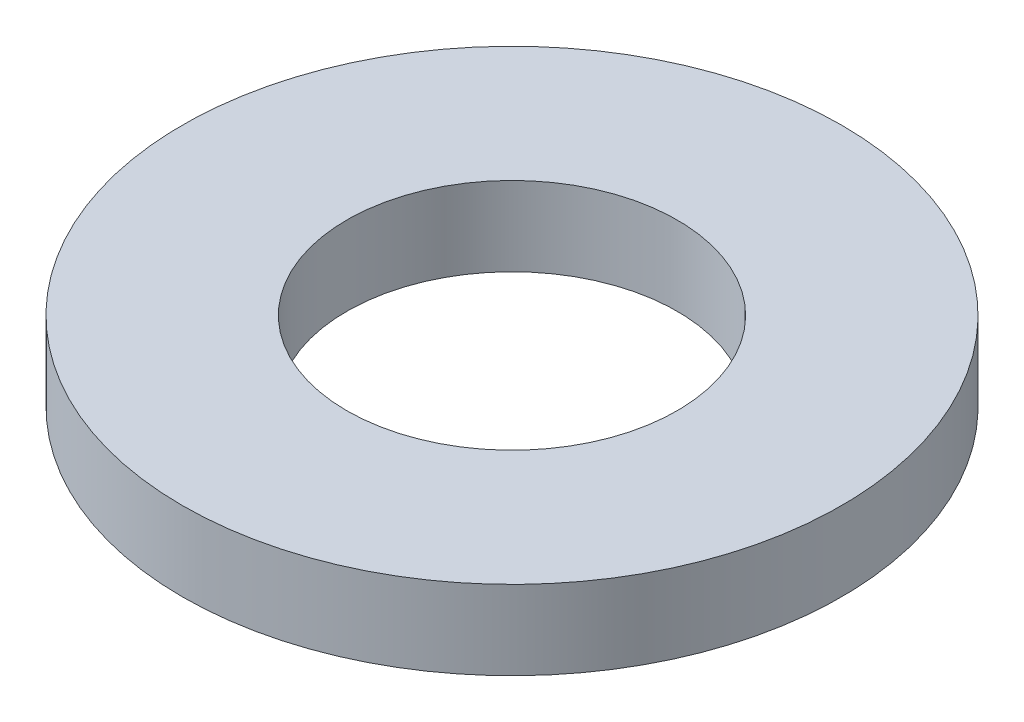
SolidWorks part; units mm, degrees
ref_plane "Front" through (0, 0, 0) normal (0, 0, 1) x (1, 0, 0)
ref_plane "Top" through (0, 0, 0) normal (0, 1, 0) x (1, 0, 0)
ref_plane "Right" through (0, 0, 0) normal (1, 0, 0) x (0, 0, -1)
sketch "Sketch1" plane through (0, 0, 0) normal (0, 1, 0) x (1, 0, 0)
  circle A0 centre (0, 0) radius 4.7625
  circle A1 centre (0, 0) radius 2.3876
  dimension "D1" = 9.525
  dimension "D2" = 4.7752
extrude "Extrude1" add sketch "Sketch1" along normal blind 1.143
